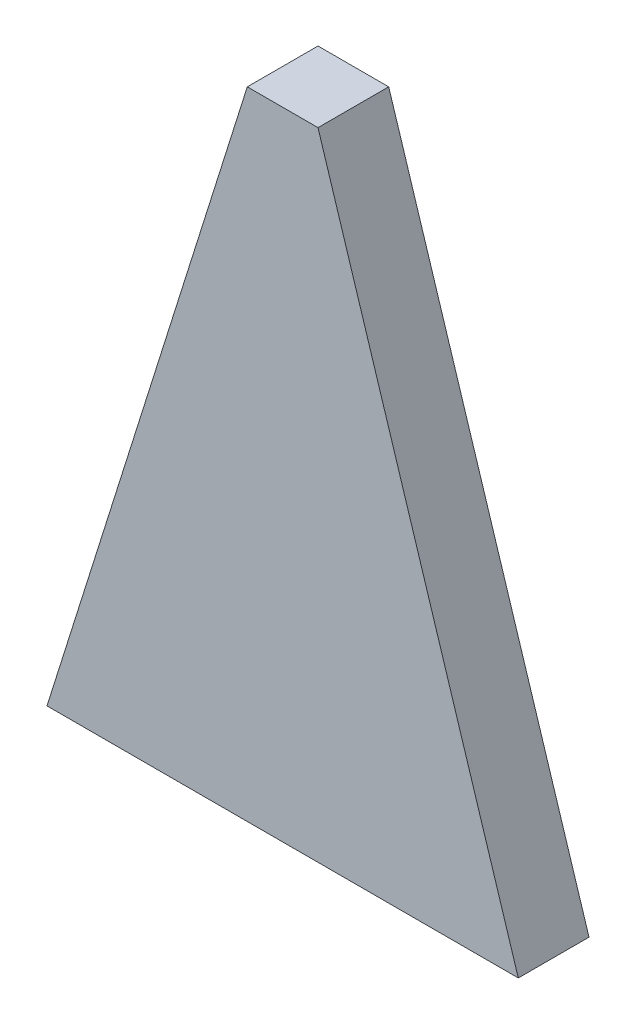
SolidWorks part; units mm, degrees
ref_plane "Plan de face" through (0, 0, 0) normal (0, 0, 1) x (1, 0, 0)
ref_plane "Plan de dessus" through (0, 0, 0) normal (0, 1, 0) x (1, 0, 0)
ref_plane "Plan de droite" through (0, 0, 0) normal (1, 0, 0) x (0, 0, -1)
sketch "Esquisse1" plane through (0, 0, 0) normal (0, 0, 1) x (1, 0, 0)
  line L0 (0, 10.1135) -> (0, -10.3151) construction
  line L1 (1.5, 27) -> (-1.5, 27)
  line L2 (-1.5, 27) -> (-10, 0)
  line L3 (-10, 0) -> (0, 0)
  line L4 (10, 0) -> (0, 0)
  line L5 (1.5, 27) -> (10, 0)
  point P9 (0, 27)
  dimension "D1" = 1.5
  dimension "D2" = 27
  dimension "D3" = 10
extrude "Boss.-Extru.1" add sketch "Esquisse1" along normal blind 3
